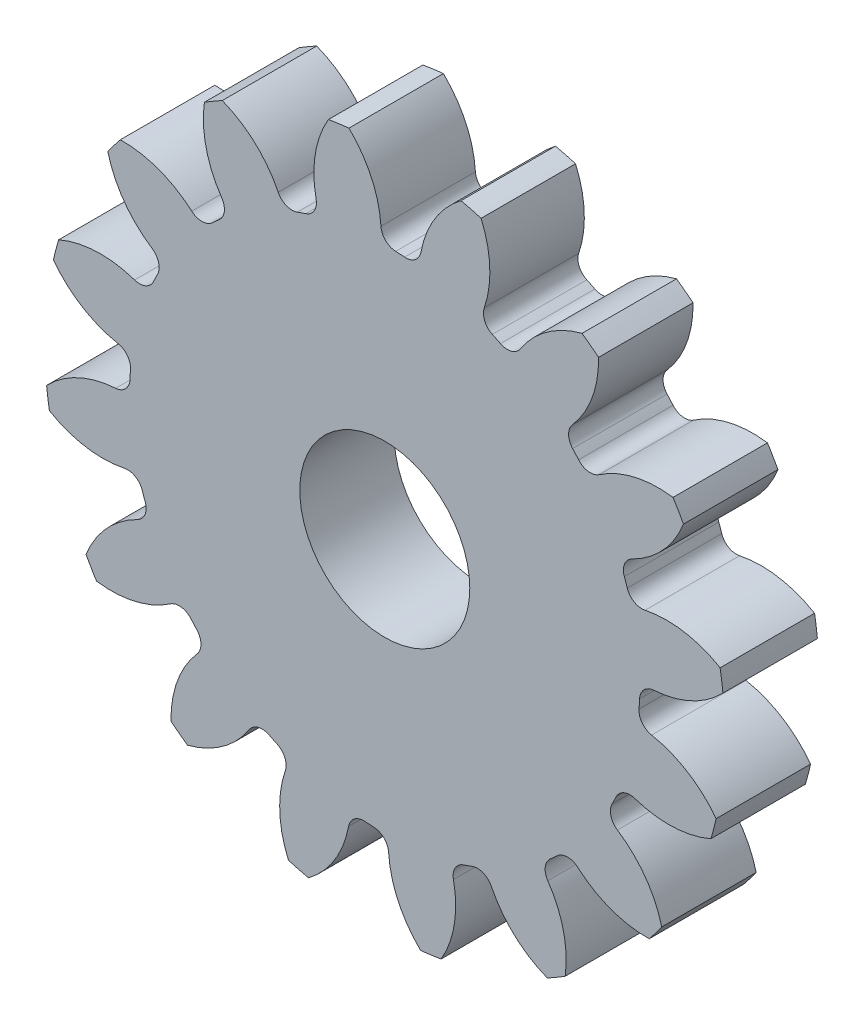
SolidWorks part; units mm, degrees
ref_plane "Front" through (0, 0, 0) normal (0, 0, 1) x (1, 0, 0)
ref_plane "Top" through (0, 0, 0) normal (0, 1, 0) x (1, 0, 0)
ref_plane "Right" through (0, 0, 0) normal (1, 0, 0) x (0, 0, -1)
sketch "Sketch3" plane through (0, 0, 0) normal (0, 0, 1) x (1, 0, 0)
  circle A0 centre (0, 0) radius 457.2
  dimension "od" = 914.4
extrude "gearBody" add sketch "Sketch3" along normal blind 127
sketch "Sketch2" plane through (0, 0, 0) normal (0, 0, 1) x (1, 0, 0)
  line L0 (0, 0) -> (352.8214, 146.1434) construction
  line L1 (447.7542, -105.5306) -> (0, 0) construction
  line L2 (0, 0) -> (36.3143, 0) construction
  line L3 (406.1134, 15.2611) -> (401.3252, -64.0236) construction
  line L5 (403.7193, -24.3813) -> (0, 0) construction
  line L7 (0, 0) -> (381.8911, 0) construction
  arc A0 (381.8107, 7.8328) -> (378.0932, -53.7246) centre (0, 0) ccw construction
  arc A1 (454.656, 48.1642) -> (445.5553, -102.5294) centre (0, 0) ccw construction
  arc A2 (406.1134, 15.2611) -> (401.3252, -64.0236) centre (0, 0) ccw construction
  arc A3 (341.8586, -26.7044) -> (342.5877, -14.6304) centre (0, 0) ccw
  arc A4 (447.7542, -105.5306) -> (358.6677, -48.6373) centre (332.6696, -187.5413) ccw
  arc A5 (447.7542, -105.5306) -> (457.2, 50.879) centre (0, 0) ccw
  arc A6 (457.2, 50.879) -> (361.9142, 5.1202) centre (352.8214, 146.1434) cw
  arc A7 (342.5877, -14.6304) -> (361.9142, 5.1202) centre (363.2445, -15.5125) cw
  arc A8 (358.6677, -48.6373) -> (341.8586, -26.7044) centre (362.4714, -28.3146) cw
  point P6 (457.2, 50.879)
  point P22 (447.7542, -105.5306)
  dimension "baseDia" = 763.7822
  dimension "od" = 914.4
  dimension "pd" = 812.8
  dimension "rd" = 685.8
  dimension "rFillet" = 20.6756
  dimension "pointX" = 457.2
  dimension "pointY" = 50.879
  dimension "CTT" = 79.2847
  dimension "flankCenterAngle" = 22.5
extrude "toothCut" cut sketch "Sketch2" along normal through all
pattern_circular "CirPattern1" count 16 over 360 about axis through (0, 0, 0) along (0, 0, 1) of "toothCut"
sketch "hub1Dia" plane through (0, 0, 0) normal (0, 0, -1) x (-1, 0, 0)
  circle A0 centre (0, 0) radius 12.7
  dimension "hub1Dia" = 25.4
sketch "hub2Dia" plane through (0, 0, 127) normal (0, 0, 1) x (1, 0, 0)
  circle A0 centre (0, 0) radius 12.7
  dimension "hub2dia" = 25.4
sketch "boreDia" plane through (0, 0, 0) normal (0, 0, 1) x (1, 0, 0)
  circle A0 centre (0, 0) radius 114.3
  dimension "boreDia" = 228.6
extrude "bore" cut sketch "boreDia" against normal mid plane 25400
